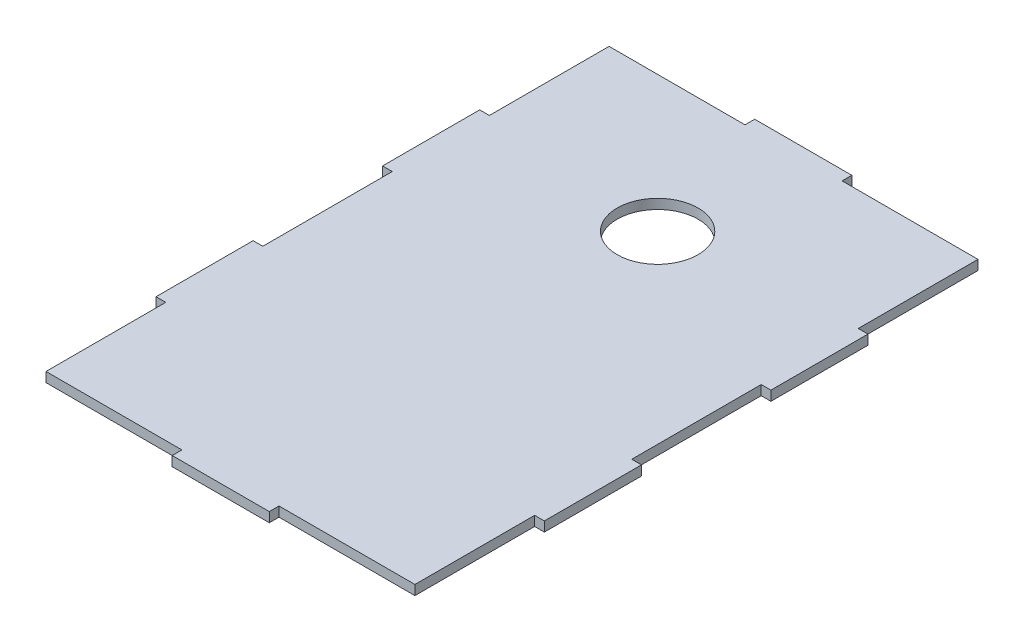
SolidWorks part; units mm, degrees
ref_plane "Front Plane" through (0, 0, 0) normal (0, 0, 1) x (1, 0, 0)
ref_plane "Top Plane" through (0, 0, 0) normal (0, 1, 0) x (1, 0, 0)
ref_plane "Right Plane" through (0, 0, 0) normal (1, 0, 0) x (0, 0, -1)
sketch "Sketch1" plane through (0, 0, 0) normal (0, 1, 0) x (1, 0, 0)
  line L1 (-60, -90) -> (60, -90)
  line L2 (-60, -90) -> (-60, 90)
  line L3 (-60, 90) -> (60, 90)
  line L4 (60, -90) -> (60, 90)
  line L5 (-60, -90) -> (60, 90) construction
  line L6 (-60, 90) -> (60, -90) construction
  point P0 (0, 0)
  dimension "D1" = 180
  dimension "D2" = 120
extrude "Boss-Extrude1" add sketch "Sketch1" along normal blind 3
sketch "Sketch3" plane through (0, 3, 0) normal (0, 1, 0) x (1, 0, 0)
  line L0 (-60, 90) -> (-60, 50)
  line L1 (-60, 90) -> (-57, 90)
  line L2 (-60, 50) -> (-57, 50)
  line L3 (-57, 90) -> (-57, 50)
  line L4 (-60, 90) -> (-60, -90) construction
  line L5 (-60, -90) -> (-57, -90)
  line L6 (-60, -90) -> (-60, -50)
  line L7 (-57, -90) -> (-57, -50)
  line L8 (-60, -50) -> (-57, -50)
  line L9 (-60, -90) -> (60, -90) construction
  line L10 (-60, -20) -> (-57, -20)
  line L11 (-60, -20) -> (-60, 20)
  line L12 (-57, -20) -> (-57, 20)
  line L13 (-60, 20) -> (-57, 20)
  point P17 (-58.5, -50)
  dimension "D1" = 3
  dimension "D2" = 30
  dimension "D3" = 30
extrude "Cut-Extrude2" cut sketch "Sketch3" against normal blind 10
mirror "Mirror1" about plane through (0, 0, 0) normal (1, 0, 0) of "Cut-Extrude2"
sketch "Sketch4" plane through (0, 3, 0) normal (0, 1, 0) x (1, 0, 0)
  line L0 (-15, -90) -> (15, -90)
  line L1 (-15, -90) -> (-15, -87)
  line L2 (15, -90) -> (15, -87)
  line L3 (-15, -87) -> (15, -87)
  line L4 (-57, -90) -> (57, -90) construction
  line L5 (0, 0) -> (0, -87) construction
  line L7 (-57, -90) -> (-15, -90)
  line L8 (-57, -90) -> (-57, -87)
  line L9 (-57, -87) -> (-15, -87)
  line L10 (-15, -90) -> (-15, -87)
  line L11 (57, -90) -> (15, -90)
  line L12 (57, -90) -> (57, -87)
  line L13 (57, -87) -> (15, -87)
  line L14 (15, -90) -> (15, -87)
  dimension "D1" = 30
  dimension "D2" = 3
extrude "Cut-Extrude3" cut sketch "Sketch4" against normal blind 10 contours L9 L1 M37 M38 | L13 L2 M39 M38 | L3
mirror "Mirror2" about plane through (0, 0, 0) normal (0, 0, 1) of "Cut-Extrude3"
sketch "Sketch8" plane through (0, 3, 0) normal (0, 1, 0) x (1, 0, 0)
  line L0 (0, 0) -> (0, 90) construction
  line L1 (15, 90) -> (-15, 90) construction
  circle A0 centre (0, 45) radius 12.5
  dimension "D1" = 25
extrude "Cut-Extrude7" cut sketch "Sketch8" against normal blind 10
sketch "Sketch5" plane through (0, 3, 0) normal (0, 1, 0) x (1, 0, 0)
  line L0 (-37, 67) -> (-37, 33.5) construction
  line L1 (-37, 33.5) -> (-37, 0) construction
  line L2 (-57, 67) -> (-37, 67)
  line L3 (-57, 50) -> (-57, 87) construction
  line L4 (-37, 67) -> (0, 67)
  line L5 (-37, 0) -> (-37, -33.5) construction
  line L6 (0, 67) -> (37, 67)
  line L7 (37, 67) -> (57, 67)
  line L8 (57, 50) -> (57, 87) construction
  line L9 (-37, 67) -> (-37, 87)
  line L10 (-57, 87) -> (-15, 87) construction
  line L11 (-37, -33.5) -> (-37, -67) construction
  line L12 (-37, -67) -> (-37, -87) construction
  line L15 (-57, -87) -> (-15, -87) construction
  circle A1 centre (-37, 67) radius 9.5724
  dimension "D1" = 20
extrude "Cut-Extrude4" [suppressed] cut sketch "Sketch5" against normal blind 10 contours L4 A1 L9 | L9 A1 L2 | L2 A1 L4
pattern_linear "LPattern1" [suppressed] count 3 spacing 37 count 5 spacing 33.5
